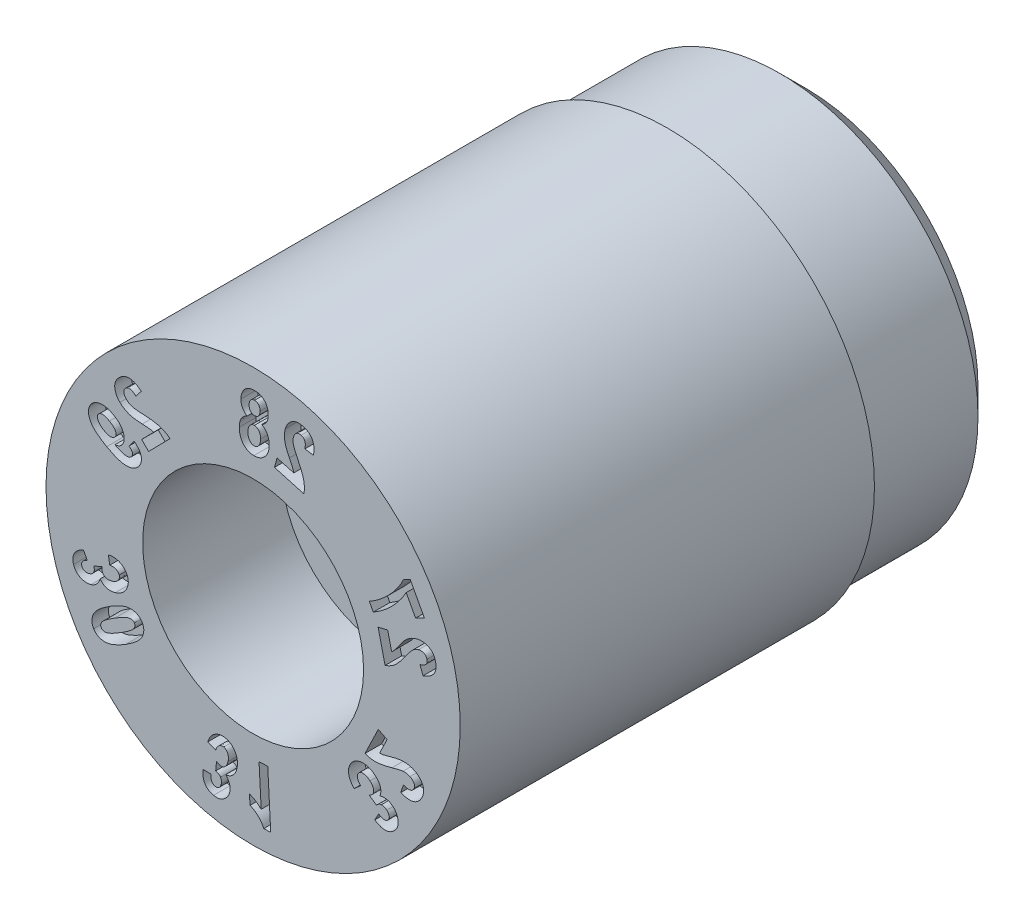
SolidWorks part; units mm, degrees
ref_plane "Front Plane" through (0, 0, 0) normal (0, 0, 1) x (1, 0, 0)
ref_plane "Top Plane" through (0, 0, 0) normal (0, 1, 0) x (1, 0, 0)
ref_plane "Right Plane" through (0, 0, 0) normal (1, 0, 0) x (0, 0, -1)
sketch "Sketch1" plane through (0, 0, 0) normal (1, 0, 0) x (0, 0, -1)
  line L2 (0, 1.5) -> (0, 0.8)
  line L3 (3.75, 1.5) -> (0, 1.5)
  line L4 (-3.7979, 0) -> (49996.2021, 0) construction
  line L8 (4, 0.5) -> (1, 0.5)
  line L9 (1, 0.8) -> (1, 0.5)
  line L10 (1, 0.8) -> (0, 0.8)
  line L12 (4, 0.5) -> (4, 1.25)
  line L16 (4, 1.25) -> (3.75, 1.5)
  dimension "D1" = 4
  dimension "D2" = 45
  dimension "D3" = 0.25
  dimension "D4" = 3
  dimension "D5" = 1.6
  dimension "D6" = 1
  dimension "D7" = 1
revolve "Revolve1" add sketch "Sketch1" angle 360 about L4
sketch "Sketch5" plane through (0, 0, 0) normal (1, 0, 0) x (0, 0, -1)
  line L0 (0, 0) -> (50000, 0) construction
  line L1 (0, 1.5) -> (0, -1.5) construction
  line L2 (3, 1.435) -> (4, 1.435)
  line L3 (3, 1.435) -> (3, 2.435)
  line L4 (3, 2.435) -> (4, 2.435)
  line L5 (4, 1.435) -> (4, 2.435)
  line L6 (4, -1.25) -> (4, 1.25) construction
  line L7 (3.75, 1.5) -> (0, 1.5) construction
  dimension "D1" = 3
  dimension "D2" = 0.065
  dimension "D3" = 1
revolve "Cut-Revolve1" cut sketch "Sketch5" angle 360 about L0
sketch "Sketch12" plane through (0, 0, 0) normal (0, 0, 1) x (1, 0, 0)
  arc A0 (0.9586, 0.0955) -> (0.9603, -0.077) centre (0, 0) ccw construction
  text T0 "27    28    29    30    31    32" font "Arial Narrow" height 0.4
extrude "Cut-Extrude3" cut sketch "Sketch12" against normal blind 0.12
